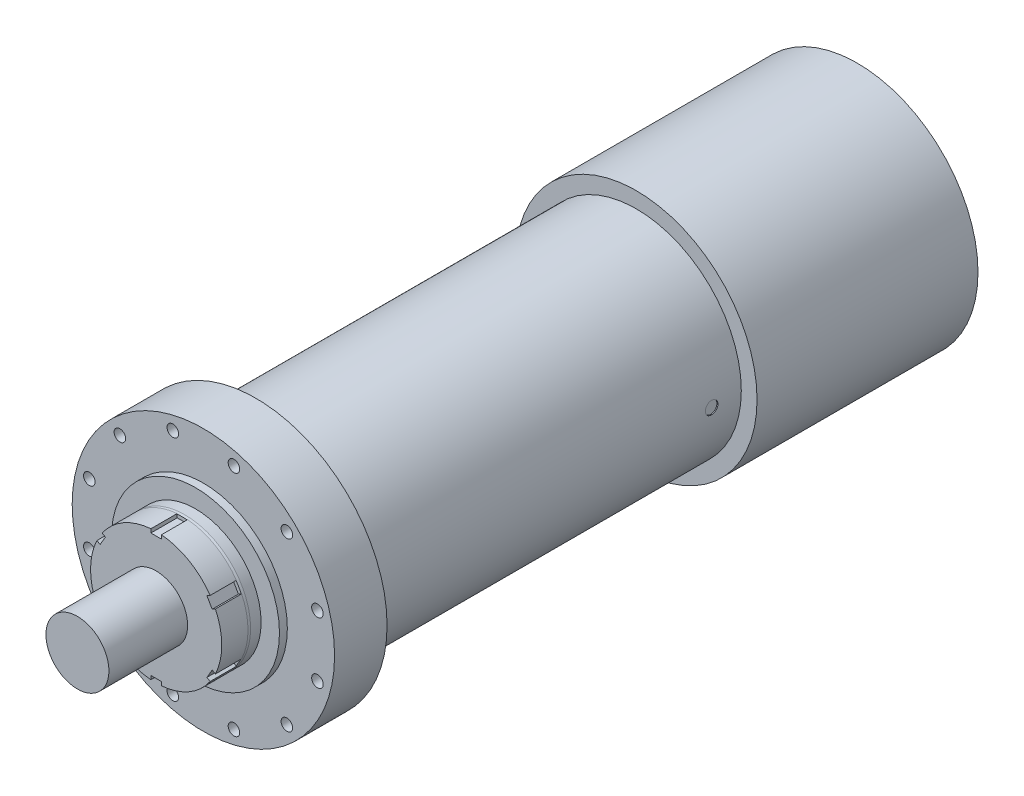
SolidWorks part; units mm, degrees
ref_plane "前视基准面" through (0, 0, 0) normal (0, 0, 1) x (1, 0, 0)
ref_plane "上视基准面" through (0, 0, 0) normal (0, 1, 0) x (1, 0, 0)
ref_plane "右视基准面" through (0, 0, 0) normal (1, 0, 0) x (0, 0, -1)
sketch "草图1" plane through (0, 0, 0) normal (0, 0, 1) x (1, 0, 0)
  circle A0 centre (0, 0) radius 200
  dimension "D1" = 400
extrude "凸台-拉伸1" add sketch "草图1" along normal blind 725
sketch "草图2" plane through (0, 0, 725) normal (0, 0, 1) x (1, 0, 0)
  line L0 (0, 0) -> (351.3656, 0) construction
  line L1 (0, 0) -> (299.4379, 80.2342) construction
  circle A0 centre (0, 0) radius 250
  circle A1 centre (0, 0) radius 225 construction
  circle A2 centre (217.3333, 58.2343) radius 11
  circle A3 centre (217.3333, -58.2343) radius 11
  circle A4 centre (159.099, -159.099) radius 11
  circle A5 centre (58.2343, -217.3333) radius 11
  circle A6 centre (-58.2343, -217.3333) radius 11
  circle A7 centre (-159.099, -159.099) radius 11
  circle A8 centre (-217.3333, -58.2343) radius 11
  circle A9 centre (-217.3333, 58.2343) radius 11
  circle A10 centre (-159.099, 159.099) radius 11
  circle A11 centre (-58.2343, 217.3333) radius 11
  circle A12 centre (58.2343, 217.3333) radius 11
  circle A13 centre (159.099, 159.099) radius 11
  point P32 (0, 0)
  dimension "D1" = 500
  dimension "D2" = 450
  dimension "D4" = 22
  dimension "D3" = 15
  dimension "D5" = 12
extrude "凸台-拉伸2" add sketch "草图2" along normal blind 100
sketch "草图3" plane through (0, 0, 825) normal (0, 0, 1) x (1, 0, 0)
  circle A0 centre (0, 0) radius 160
  dimension "D1" = 320
extrude "凸台-拉伸3" add sketch "草图3" along normal blind 15
sketch "草图4" plane through (0, 0, 840) normal (0, 0, 1) x (1, 0, 0)
  circle A1 centre (0, 0) radius 125
  dimension "D1" = 250
extrude "凸台-拉伸4" add sketch "草图4" along normal blind 25
chamfer "倒角1" distance 5 angle 10 1 edges at (125, 0, 865)
sketch "草图5" plane through (0, 0, 865) normal (0, 0, 1) x (1, 0, 0)
  line L0 (-10, 124.5994) -> (-10, 117.5)
  line L1 (-10, 117.5) -> (10, 117.5)
  line L2 (10, 117.5) -> (10, 124.5994)
  line L3 (102.9062, 70.9599) -> (96.758, 67.4103)
  line L4 (96.758, 67.4103) -> (106.758, 50.0897)
  line L5 (106.758, 50.0897) -> (112.9062, 53.6394)
  line L6 (112.9062, -53.6394) -> (106.758, -50.0897)
  line L7 (106.758, -50.0897) -> (96.758, -67.4103)
  line L8 (96.758, -67.4103) -> (102.9062, -70.9599)
  line L9 (10, -124.5994) -> (10, -117.5)
  line L10 (10, -117.5) -> (-10, -117.5)
  line L11 (-10, -117.5) -> (-10, -124.5994)
  line L12 (-102.9062, -70.9599) -> (-96.758, -67.4103)
  line L13 (-96.758, -67.4103) -> (-106.758, -50.0897)
  line L14 (-106.758, -50.0897) -> (-112.9062, -53.6394)
  line L15 (-112.9062, 53.6394) -> (-106.758, 50.0897)
  line L16 (-106.758, 50.0897) -> (-96.758, 67.4103)
  line L17 (-96.758, 67.4103) -> (-102.9062, 70.9599)
  arc A0 (-10, 124.5994) -> (-102.9062, 70.9599) centre (0, 0) ccw
  arc A1 (-112.9062, 53.6394) -> (-112.9062, -53.6394) centre (0, 0) ccw
  arc A2 (-102.9062, -70.9599) -> (-10, -124.5994) centre (0, 0) ccw
  arc A3 (10, -124.5994) -> (102.9062, -70.9599) centre (0, 0) ccw
  arc A4 (112.9062, -53.6394) -> (112.9062, 53.6394) centre (0, 0) ccw
  arc A5 (102.9062, 70.9599) -> (10, 124.5994) centre (0, 0) ccw
  point P28 (0, 0)
  dimension "D1" = 250
  dimension "D2" = 20
  dimension "D3" = 10
  dimension "D4" = 117.5
  dimension "D5" = 6
sketch "草图6" plane through (0, 0, 0) normal (0, 0, -1) x (-1, 0, 0)
  circle A0 centre (0, 0) radius 230
  dimension "D1" = 460
extrude "凸台-拉伸6" add sketch "草图6" along normal blind 421
ref_plane "基准面1" through (-200, 0, 0) normal (1, 0, 0) x (0, 0, -1)
sketch "草图9" plane through (-200, 0, 0) normal (1, 0, 0) x (0, 0, -1)
  line L0 (-725, -200) -> (-725, 200) construction
  circle A0 centre (-36.5, 0) radius 12
  circle A1 centre (-670.5, 0) radius 12
  dimension "D1" = 24
  dimension "D2" = 24
  dimension "D3" = 36.5
  dimension "D4" = 54.5
extrude "切除-拉伸2" cut sketch "草图9" along normal blind 2
ref_plane "基准面2" through (200, 0, 0) normal (1, 0, 0) x (0, 0, -1)
sketch "草图10" plane through (200, 0, 0) normal (1, 0, 0) x (0, 0, -1)
  circle A0 centre (-56.5, 0) radius 12
  dimension "D1" = 56.5
  dimension "D2" = 24
extrude "切除-拉伸3" cut sketch "草图10" against normal blind 2
extrude "凸台-拉伸7" add sketch "草图5" along normal blind 50
sketch "草图11" plane through (0, 0, 915) normal (0, 0, 1) x (1, 0, 0)
  circle A0 centre (0, 0) radius 60
  dimension "D1" = 120
extrude "凸台-拉伸8" add sketch "草图11" along normal blind 150
